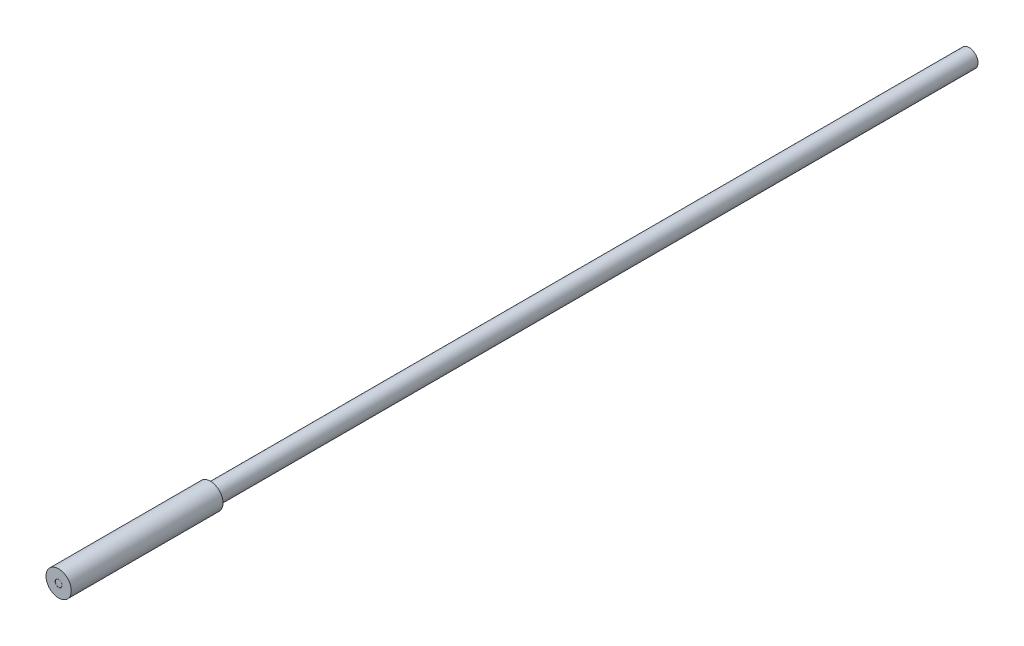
SolidWorks part; units mm, degrees
ref_plane "前视基准面" through (0, 0, 0) normal (0, 0, 1) x (1, 0, 0)
ref_plane "上视基准面" through (0, 0, 0) normal (0, 1, 0) x (1, 0, 0)
ref_plane "右视基准面" through (0, 0, 0) normal (1, 0, 0) x (0, 0, -1)
sketch "草图1" plane through (0, 0, 0) normal (0, 0, 1) x (1, 0, 0)
  circle A0 centre (0, 0) radius 0.5
  dimension "D1" = 1
extrude "凸台-拉伸1" add sketch "草图1" against normal blind 6
sketch "草图2" plane through (0, 0, -6) normal (0, 0, -1) x (-1, 0, 0)
  circle A0 centre (0, 0) radius 0.35
  dimension "D1" = 0.7
extrude "凸台-拉伸2" add sketch "草图2" along normal blind 30
sketch "草图3" plane through (0, 0, 0) normal (0, 0, 1) x (1, 0, 0)
  circle A0 centre (0, 0) radius 0.1325
  circle A1 centre (0, 0) radius 0.1375
  dimension "D1" = 0.275
  dimension "D2" = 0.265
extrude "切除-拉伸1" cut sketch "草图3" against normal blind 0.1
